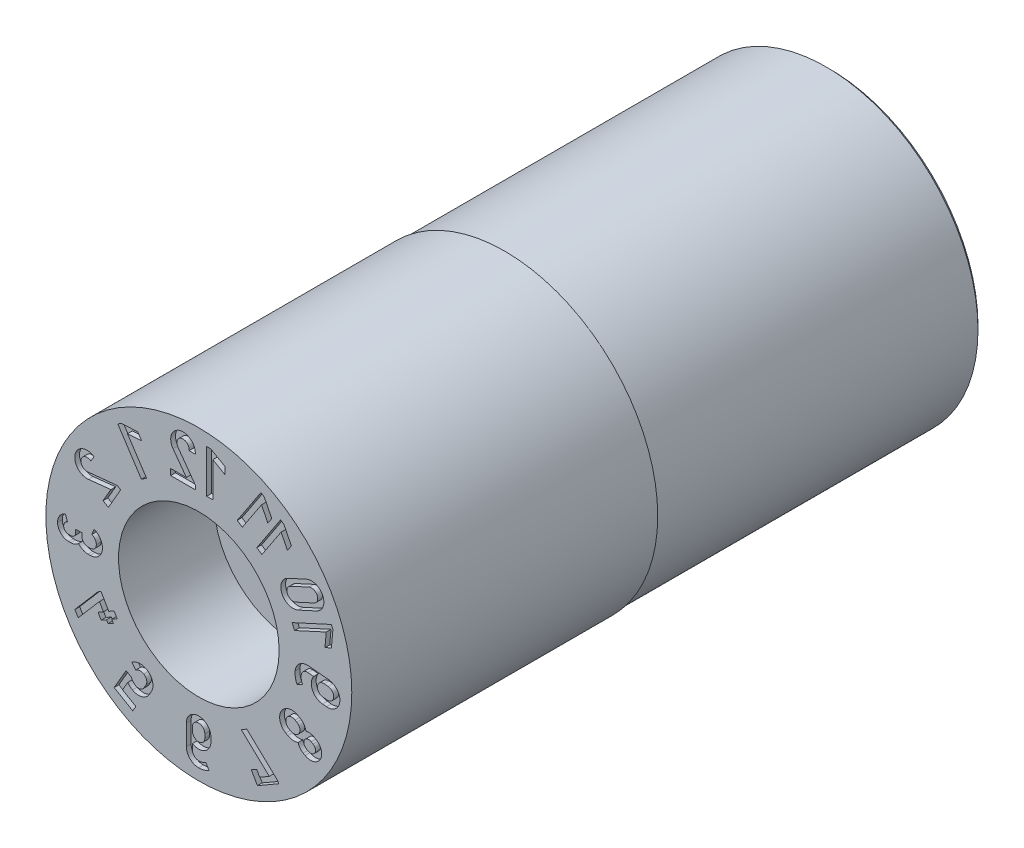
SolidWorks part; units mm, degrees
ref_plane "Front Plane" through (0, 0, 0) normal (0, 0, 1) x (1, 0, 0)
ref_plane "Top Plane" through (0, 0, 0) normal (0, 1, 0) x (1, 0, 0)
ref_plane "Right Plane" through (0, 0, 0) normal (1, 0, 0) x (0, 0, -1)
sketch "Sketch1" plane through (0, 0, 0) normal (1, 0, 0) x (0, 0, -1)
  line L2 (0, 8) -> (0, 4.2)
  line L3 (32.75, 8) -> (0, 8)
  line L4 (-3.7979, 0) -> (49996.2021, 0) construction
  line L8 (25, 1.75) -> (5, 1.75)
  line L9 (5, 4.2) -> (5, 1.75)
  line L10 (5, 4.2) -> (0, 4.2)
  line L12 (33, 4) -> (33, 7.75)
  line L16 (33, 7.75) -> (32.75, 8)
  line L17 (33, 4) -> (25, 4)
  line L18 (25, 1.75) -> (25, 4)
  dimension "D1" = 33
  dimension "D2" = 45
  dimension "D3" = 0.25
  dimension "D4" = 16
  dimension "D5" = 8.4
  dimension "D6" = 5
  dimension "D7" = 3.5
  dimension "D8" = 8
  dimension "D9" = 8
revolve "Revolve1" add sketch "Sketch1" angle 360 about L4
sketch "Sketch4" plane through (0, 0, 0) normal (1, 0, 0) x (0, 0, -1)
  line L0 (0, 0) -> (50000, 0) construction
  line L1 (33, -7.75) -> (33, 7.75) construction
  line L2 (16, 8.935) -> (33, 8.935)
  line L3 (16, 8.935) -> (16, 7.935)
  line L4 (16, 7.935) -> (33, 7.935)
  line L5 (33, 8.935) -> (33, 7.935)
  line L6 (32.75, 8) -> (0, 8) construction
  line L9 (0, 8.8) -> (0, -8.8) construction
  dimension "D1" = 1
  dimension "D2" = 0.065
  dimension "D3" = 16
revolve "Cut-Revolve1" cut sketch "Sketch4" angle 360 about L0
sketch "Sketch2" plane through (0, 0, 0) normal (0, 0, 1) x (1, 0, 0)
  line L805 (4.2743, 5.965) -> (4.451, 5.8481)
  line L806 (4.451, 5.8481) -> (4.8409, 5.0709)
  line L807 (4.8409, 5.0709) -> (4.6362, 4.7611)
  line L808 (4.6362, 4.7611) -> (4.3031, 5.4249)
  line L809 (4.3031, 5.4249) -> (3.3003, 3.9076)
  line L810 (3.3003, 3.9076) -> (3.0318, 4.0851)
  line L811 (3.0318, 4.0851) -> (4.2743, 5.965)
  line L812 (3.2492, 6.688) -> (3.426, 6.5711)
  line L813 (3.426, 6.5711) -> (3.8158, 5.7939)
  line L814 (3.8158, 5.7939) -> (3.6111, 5.4842)
  line L815 (3.6111, 5.4842) -> (3.2781, 6.1479)
  line L816 (3.2781, 6.1479) -> (2.2752, 4.6306)
  line L817 (2.2752, 4.6306) -> (2.0067, 4.8081)
  line L818 (2.0067, 4.8081) -> (3.2492, 6.688)
  line L819 (5.0653, 2.6345) -> (6.0307, 3.0779)
  line L820 (5.7619, 3.663) -> (4.7965, 3.2196)
  line L821 (6.7641, -0.3352) -> (6.5558, -0.3158)
  line L822 (6.496, -0.9568) -> (6.7042, -0.9762)
  line L823 (6.794, -0.0145) -> (5.7363, 0.084)
  line L824 (5.1357, -1.0562) -> (5.4263, -0.9165)
  line L825 (6.6739, -1.2966) -> (6.466, -1.2779)
  line L826 (6.0005, -0.264) -> (5.7063, -0.2365)
  line L827 (5.6205, -3.728) -> (5.7181, -3.7842)
  line L828 (5.9756, -3.3382) -> (5.8781, -3.2818)
  line L829 (2.2182, -4.5641) -> (2.5092, -4.3961)
  line L830 (2.5092, -4.3961) -> (4.104, -5.8989)
  line L831 (4.104, -5.8989) -> (4.1812, -6.0327)
  line L832 (4.1812, -6.0327) -> (3.0661, -6.6766)
  line L833 (3.0661, -6.6766) -> (2.7442, -6.119)
  line L834 (2.7442, -6.119) -> (3.023, -5.958)
  line L835 (3.023, -5.958) -> (3.1839, -6.2368)
  line L836 (3.1839, -6.2368) -> (3.6857, -5.9471)
  line L837 (3.6857, -5.9471) -> (2.2182, -4.5641)
  line L838 (4.7102, -3.2766) -> (4.8078, -3.333)
  line L839 (5.1296, -2.7754) -> (5.0321, -2.7189)
  line L840 (5.2906, -2.4966) -> (5.1931, -2.4402)
  line L841 (4.5493, -3.5553) -> (4.6468, -3.6116)
  line L842 (5.4596, -4.0067) -> (5.5572, -4.063)
  line L843 (6.1364, -3.0596) -> (6.039, -3.0029)
  line L844 (6.9244, 2.5534) -> (7.0128, 2.3608)
  line L845 (7.0128, 2.3608) -> (6.9335, 1.4949)
  line L846 (6.9335, 1.4949) -> (6.5962, 1.34)
  line L847 (6.5962, 1.34) -> (6.6638, 2.0795)
  line L848 (6.6638, 2.0795) -> (5.011, 1.3204)
  line L849 (5.011, 1.3204) -> (4.8767, 1.6129)
  line L850 (4.8767, 1.6129) -> (6.9244, 2.5534)
  line L851 (5.6275, 3.9556) -> (4.6622, 3.5122)
  line L852 (5.1997, 2.3419) -> (6.165, 2.7853)
  line L853 (0.4121, 7.357) -> (0.624, 7.357)
  line L854 (0.624, 7.357) -> (1.3778, 6.9235)
  line L855 (1.3778, 6.9235) -> (1.3778, 6.5523)
  line L856 (1.3778, 6.5523) -> (0.734, 6.9224)
  line L857 (0.734, 6.9224) -> (0.734, 5.1036)
  line L858 (0.734, 5.1036) -> (0.4121, 5.1036)
  line L859 (0.4121, 5.1036) -> (0.4121, 7.357)
  line L860 (-1.47, 5.0987) -> (-0.1823, 5.0987)
  line L861 (-0.1823, 5.0987) -> (-0.1823, 5.3116)
  line L862 (-0.1823, 5.3116) -> (-1.0876, 6.5683)
  line L863 (-0.5079, 6.7082) -> (-0.1841, 6.7082)
  line L864 (-1.3492, 6.3799) -> (-0.6491, 5.4206)
  line L865 (-0.6491, 5.4206) -> (-1.47, 5.4206)
  line L866 (-1.47, 5.4206) -> (-1.47, 5.0987)
  line L867 (-4.2364, 6.0526) -> (-4.0591, 6.1686)
  line L868 (-4.0591, 6.1686) -> (-3.191, 6.2188)
  line L869 (-3.191, 6.2188) -> (-2.9877, 5.9081)
  line L870 (-2.9877, 5.9081) -> (-3.7291, 5.8652)
  line L871 (-3.7291, 5.8652) -> (-2.7331, 4.3434)
  line L872 (-2.7331, 4.3434) -> (-3.0024, 4.1672)
  line L873 (-3.0024, 4.1672) -> (-4.2364, 6.0526)
  line L874 (-0.3321, -5.7008) -> (-0.3321, -5.91)
  line L875 (0.3118, -5.91) -> (0.3118, -5.7008)
  line L876 (0.6335, -5.7012) -> (0.6343, -5.91)
  line L877 (-0.332, -6.4676) -> (-0.3321, -6.7631)
  line L878 (-0.6541, -5.7008) -> (-0.6539, -6.7631)
  line L879 (0.5371, -7.2552) -> (0.371, -6.9787)
  line L880 (-3.7145, -5.3899) -> (-3.9895, -5.8662)
  line L881 (-3.9895, -5.8662) -> (-3.2925, -6.2687)
  line L882 (-3.2925, -6.2687) -> (-3.4535, -6.5475)
  line L883 (-3.4535, -6.5475) -> (-4.4292, -5.9842)
  line L884 (-4.4292, -5.9842) -> (-3.8044, -4.9019)
  line L885 (-3.8044, -4.9019) -> (-3.5257, -5.0629)
  line L886 (-2.8687, -5.2124) -> (-2.764, -5.0313)
  line L887 (-3.2972, -4.6223) -> (-3.4977, -4.3701)
  line L888 (-2.4852, -5.1922) -> (-2.59, -5.3732)
  line L889 (-5.6833, -0.2984) -> (-5.7959, -0.2984)
  line L890 (-6.1178, 0.0235) -> (-6.1178, 0.1844)
  line L891 (-6.1178, 0.1844) -> (-6.4397, 0.1844)
  line L892 (-6.4397, 0.1844) -> (-6.4397, 0.0235)
  line L893 (-6.6972, -0.234) -> (-6.8099, -0.234)
  line L894 (-6.8705, 0.298) -> (-6.9735, 0.603)
  line L895 (-6.8099, -0.556) -> (-6.6972, -0.556)
  line L896 (-5.7959, -0.6203) -> (-5.6832, -0.6203)
  line L897 (-5.4776, 0.6673) -> (-5.5957, 0.368)
  line L898 (-6.4801, -3.4676) -> (-6.3096, -3.7629)
  line L899 (-6.3096, -3.7629) -> (-5.1974, -2.4703)
  line L900 (-5.1974, -2.4703) -> (-4.9889, -2.8314)
  line L901 (-4.9889, -2.8314) -> (-5.2676, -2.9924)
  line L902 (-5.2676, -2.9924) -> (-5.1067, -3.2711)
  line L903 (-5.1067, -3.2711) -> (-4.8279, -3.1102)
  line L904 (-4.8279, -3.1102) -> (-4.7474, -3.2496)
  line L905 (-4.7474, -3.2496) -> (-4.4687, -3.0887)
  line L906 (-4.4687, -3.0887) -> (-4.5492, -2.9493)
  line L907 (-4.5492, -2.9493) -> (-4.2703, -2.7883)
  line L908 (-4.2703, -2.7883) -> (-4.4313, -2.5095)
  line L909 (-4.4313, -2.5095) -> (-4.7101, -2.6705)
  line L910 (-4.7101, -2.6705) -> (-5.1125, -1.9735)
  line L911 (-5.1125, -1.9735) -> (-5.2755, -2.0676)
  line L912 (-5.2755, -2.0676) -> (-6.4801, -3.4676)
  line L913 (-5.0093, 2.1901) -> (-4.7304, 2.0291)
  line L914 (-4.7304, 2.0291) -> (-4.0866, 3.1443)
  line L915 (-4.0866, 3.1443) -> (-4.271, 3.2507)
  line L916 (-4.271, 3.2507) -> (-5.812, 3.0952)
  line L917 (-5.6433, 3.6671) -> (-5.4814, 3.9475)
  line L918 (-5.7796, 2.7743) -> (-4.5988, 2.9011)
  line L919 (-4.5988, 2.9011) -> (-5.0093, 2.1901)
  arc A378 (4.7965, 3.2196) -> (5.0653, 2.6345) centre (4.9309, 2.9271) ccw
  arc A379 (6.0307, 3.0779) -> (5.7619, 3.663) centre (5.8963, 3.3704) ccw
  arc A380 (6.5558, -0.3158) -> (6.496, -0.9568) centre (6.5259, -0.6363) ccw
  arc A381 (6.7042, -0.9762) -> (6.7641, -0.3352) centre (6.7341, -0.6557) ccw
  arc A382 (5.7363, 0.084) -> (5.0354, -0.4972) centre (5.6765, -0.5572) ccw
  arc A383 (5.0354, -0.4972) -> (5.1357, -1.0562) centre (6.0922, -0.5961) ccw
  arc A384 (6.6739, -1.2966) -> (6.794, -0.0145) centre (6.734, -0.6556) ccw
  arc A385 (6.0005, -0.264) -> (6.466, -1.2779) centre (6.5235, -0.6377) ccw
  arc A386 (5.7063, -0.2365) -> (5.3591, -0.5026) centre (5.6764, -0.557) ccw
  arc A387 (5.3591, -0.5026) -> (5.4263, -0.9165) centre (5.9959, -0.6117) ccw
  arc A388 (5.8781, -3.2818) -> (5.6205, -3.728) centre (5.7489, -3.5047) ccw
  arc A389 (5.7181, -3.7842) -> (5.9756, -3.3382) centre (5.8468, -3.5612) ccw
  arc A390 (5.0321, -2.7189) -> (4.7102, -3.2766) centre (4.8713, -2.9978) ccw
  arc A391 (4.8078, -3.333) -> (5.1296, -2.7754) centre (4.9687, -3.0542) ccw
  arc A392 (5.6031, -2.9441) -> (5.2906, -2.4966) centre (4.9687, -3.0542) ccw
  arc A393 (5.1931, -2.4402) -> (4.5493, -3.5553) centre (4.8707, -2.9975) ccw
  arc A394 (4.6468, -3.6116) -> (5.1906, -3.6585) centre (4.9687, -3.0542) ccw
  arc A395 (5.1906, -3.6585) -> (5.4596, -4.0067) centre (5.7499, -3.5044) ccw
  arc A396 (5.5572, -4.063) -> (6.1364, -3.0596) centre (5.8468, -3.5613) ccw
  arc A397 (6.039, -3.0029) -> (5.6031, -2.9441) centre (5.75, -3.4999) ccw
  arc A398 (4.6622, 3.5122) -> (5.1997, 2.3419) centre (4.9309, 2.9271) ccw
  arc A399 (6.165, 2.7853) -> (5.6275, 3.9556) centre (5.8963, 3.3704) ccw
  arc A400 (-0.5079, 6.7082) -> (-1.0876, 6.5683) centre (-0.8263, 6.7565) ccw
  arc A401 (-0.1841, 6.7082) -> (-1.3492, 6.3799) centre (-0.8264, 6.7562) ccw
  arc A402 (-0.3321, -5.91) -> (0.3118, -5.91) centre (-0.0102, -5.91) ccw
  arc A403 (0.3118, -5.7008) -> (-0.3321, -5.7008) centre (-0.0102, -5.7008) ccw
  arc A404 (0.6335, -5.7012) -> (-0.6541, -5.7008) centre (-0.0103, -5.701) ccw
  arc A405 (-0.332, -6.4676) -> (0.6343, -5.91) centre (-0.0085, -5.9122) ccw
  arc A406 (-0.3321, -6.7631) -> (-0.0349, -7.084) centre (-0.0102, -6.7631) ccw
  arc A407 (-0.0349, -7.084) -> (0.371, -6.9787) centre (0.0146, -6.4399) ccw
  arc A408 (-0.6539, -6.7631) -> (-0.0102, -7.4069) centre (-0.01, -6.763) ccw
  arc A409 (-0.0102, -7.4069) -> (0.5371, -7.2552) centre (-0.0099, -6.3455) ccw
  arc A410 (-3.5257, -5.0629) -> (-3.3084, -5.3303) centre (-3.0666, -4.9118) ccw
  arc A411 (-3.3084, -5.3303) -> (-2.8687, -5.2124) centre (-3.1474, -5.0517) ccw
  arc A412 (-2.764, -5.0313) -> (-2.8819, -4.5916) centre (-3.0426, -4.8703) ccw
  arc A413 (-2.8819, -4.5916) -> (-3.2972, -4.6223) centre (-3.0669, -4.9125) ccw
  arc A414 (-2.7209, -4.3127) -> (-3.4977, -4.3701) centre (-3.0672, -4.9115) ccw
  arc A415 (-2.4852, -5.1922) -> (-2.7209, -4.3127) centre (-3.0434, -4.8705) ccw
  arc A416 (-3.4694, -5.609) -> (-2.59, -5.3732) centre (-3.148, -5.0501) ccw
  arc A417 (-3.7145, -5.3899) -> (-3.4694, -5.609) centre (-3.0715, -4.9172) ccw
  arc A418 (-5.3614, 0.0235) -> (-5.5957, 0.368) centre (-5.7316, 0.0235) ccw
  arc A419 (-5.6833, -0.2984) -> (-5.3614, 0.0235) centre (-5.6833, 0.0235) ccw
  arc A420 (-6.1178, 0.0235) -> (-5.7959, -0.2984) centre (-5.7959, 0.0235) ccw
  arc A421 (-6.6972, -0.234) -> (-6.4397, 0.0235) centre (-6.6972, 0.0235) ccw
  arc A422 (-7.0674, 0.0235) -> (-6.8099, -0.234) centre (-6.8097, 0.0237) ccw
  arc A423 (-6.8705, 0.298) -> (-7.0674, 0.0235) centre (-6.7781, 0.0238) ccw
  arc A424 (-6.9735, 0.603) -> (-7.3893, 0.0235) centre (-6.7775, 0.0234) ccw
  arc A425 (-7.3893, 0.0235) -> (-6.8099, -0.556) centre (-6.81, 0.0234) ccw
  arc A426 (-6.6972, -0.556) -> (-6.2903, -0.389) centre (-6.6972, 0.0232) ccw
  arc A427 (-6.2903, -0.389) -> (-5.7959, -0.6203) centre (-5.7961, 0.0232) ccw
  arc A428 (-5.6832, -0.6203) -> (-5.0395, 0.0235) centre (-5.6832, 0.0234) ccw
  arc A429 (-5.0395, 0.0235) -> (-5.4776, 0.6673) centre (-5.7318, 0.0234) ccw
  arc A430 (-5.6433, 3.6671) -> (-5.812, 3.0952) centre (-5.8443, 3.4155) ccw
  arc A431 (-5.4814, 3.9475) -> (-5.7796, 2.7743) centre (-5.8441, 3.4152) ccw
  point P1556 (0, 0.0125)
  point P1557 (0.0125, 0.0125)
  point P1558 (0.0125, 0)
extrude "Cut-Extrude1" cut sketch "Sketch2" against normal blind 0.25
sketch "Sketch3" plane through (0, 0, -5) normal (0, 0, 1) x (1, 0, 0)
  line L0 (0, 0) -> (0, 50000) construction
  line L1 (1.0104, 1.75) -> (-1.0104, 1.75)
  line L2 (-1.0104, 1.75) -> (-2.0207, 0)
  line L3 (-2.0207, 0) -> (-1.0104, -1.75)
  line L4 (-1.0104, -1.75) -> (1.0104, -1.75)
  line L5 (1.0104, -1.75) -> (2.0207, 0)
  line L6 (2.0207, 0) -> (1.0104, 1.75)
  line L7 (0, 0) -> (50000, 0) construction
  circle A0 centre (0, 0) radius 1.75 construction
  circle A1 centre (0, 0) radius 1.75 construction
extrude "Cut-Extrude2" cut sketch "Sketch3" against normal blind 4
